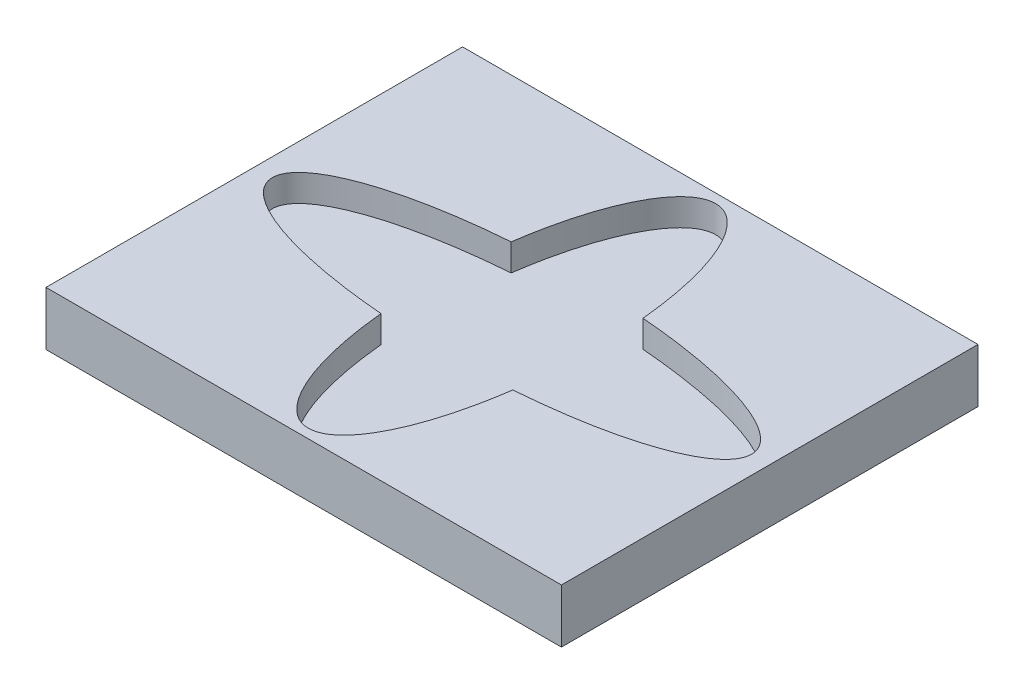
SolidWorks part; units mm, degrees
ref_plane "Front Plane" through (0, 0, 0) normal (0, 0, 1) x (1, 0, 0)
ref_plane "Top Plane" through (0, 0, 0) normal (0, 1, 0) x (1, 0, 0)
ref_plane "Right Plane" through (0, 0, 0) normal (1, 0, 0) x (0, 0, -1)
sketch "Sketch1" plane through (0, 0, 0) normal (0, 1, 0) x (1, 0, 0)
  line L1 (95.7138, -77.3596) -> (-95.7138, -77.3596)
  line L2 (95.7138, -77.3596) -> (95.7138, 77.3596)
  line L3 (95.7138, 77.3596) -> (-95.7138, 77.3596)
  line L4 (-95.7138, -77.3596) -> (-95.7138, 77.3596)
  line L5 (95.7138, -77.3596) -> (-95.7138, 77.3596) construction
  line L6 (95.7138, 77.3596) -> (-95.7138, -77.3596) construction
  point P0 (0, 0)
  dimension "D1" = 191.4276
  dimension "D2" = 154.7191
extrude "Boss-Extrude1" add sketch "Sketch1" along normal blind 20
sketch "Sketch2" plane through (0, 20, 0) normal (0, 1, 0) x (1, 0, 0)
  ellipse E0 centre (0, 0) end of major axis (-88.9862, 0) minor radius 24.574 (-23.9687, 23.6658) -> (-25.0717, -23.5785) ccw
  ellipse E1 centre (0, 0) end of major axis (1.9486, 73.9386) minor radius 25.8694 (-25.0717, -23.5785) -> (23.9687, -23.6658) ccw
  ellipse E2 centre (0, 0) end of major axis (-88.9862, 0) minor radius 24.574 (23.9687, -23.6658) -> (25.0717, 23.5785) ccw
  ellipse E3 centre (0, 0) end of major axis (1.9486, 73.9386) minor radius 25.8694 (25.0717, 23.5785) -> (-23.9687, 23.6658) ccw
extrude "Cut-Extrude1" cut sketch "Sketch2" against normal blind 10
